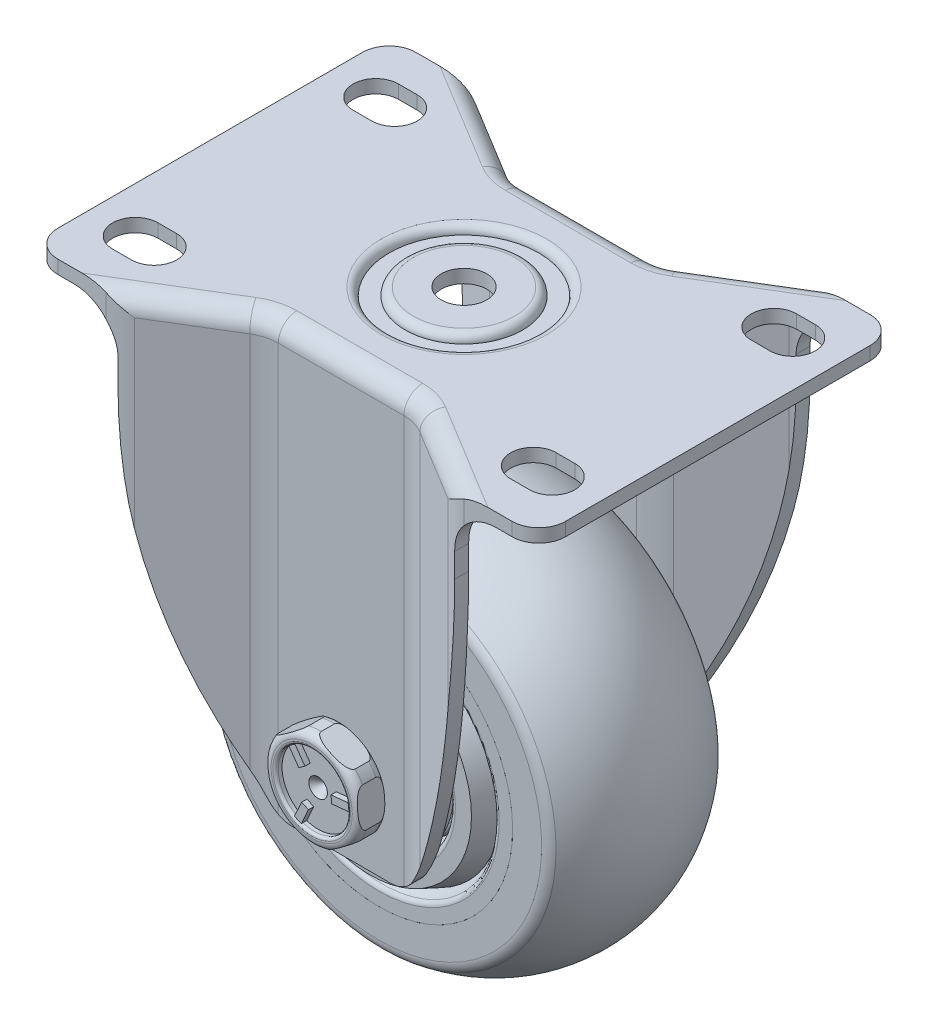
SolidWorks part; units mm, degrees
ref_plane "前视基准面" through (0, 0, 0) normal (0, 0, 1) x (1, 0, 0)
ref_plane "上视基准面" through (0, 0, 0) normal (0, 1, 0) x (1, 0, 0)
ref_plane "右视基准面" through (0, 0, 0) normal (1, 0, 0) x (0, 0, -1)
imported_body "3寸双轴内芯_默认-1-solid1"
imported_body "轴承6001_默认-1-solid1"
imported_body "轴承6001_默认-1-solid2"
imported_body "轴承6001_默认-1-solid3"
imported_body "轴承6001_默认-1-solid4"
imported_body "轴承6001_默认-1-solid5"
imported_body "轴承6001_默认-1-solid6"
imported_body "轴承6001_默认-1-solid7"
imported_body "轴承6001_默认-1-solid8"
imported_body "轴承6001_默认-1-solid9"
imported_body "轴承6001_默认-1-solid10"
imported_body "3寸固定支架_默认-1-solid1"
imported_body "轴承6001_默认-2-solid1"
imported_body "轴承6001_默认-2-solid2"
imported_body "轴承6001_默认-2-solid3"
imported_body "轴承6001_默认-2-solid4"
imported_body "轴承6001_默认-2-solid5"
imported_body "轴承6001_默认-2-solid6"
imported_body "轴承6001_默认-2-solid7"
imported_body "轴承6001_默认-2-solid8"
imported_body "轴承6001_默认-2-solid9"
imported_body "轴承6001_默认-2-solid10"
imported_body "M10-55螺杆-1-solid1"
imported_body "双轴盖仔_默认-1-solid1"
imported_body "40.2mm中型中管_默认-1-solid1"
imported_body "双轴盖仔_默认-2-solid1"
imported_body "3寸半孤平边外包_默认-1-solid1"
imported_body "M10螺母-1-solid1"
sketch "草图1" plane through (0, 0, 23) normal (0, 0, 1) x (1, 0, 0)
  line L1 (-8.6327, -6.4342) -> (3.717, -6.4342)
  line L2 (-8.6327, -6.4342) -> (-8.6327, -35.0979)
  line L3 (-8.6327, -35.0979) -> (3.717, -35.0979)
  line L4 (3.717, -6.4342) -> (3.717, -35.0979)
extrude "凸台-拉伸1" add sketch "草图1" against normal blind 1
sketch "草图2" plane through (0, 0, -16.1) normal (0, 0, -1) x (-1, 0, 0)
  circle A0 centre (3.1439, -51.6986) radius 30.4248
  circle A1 centre (3.1439, -51.6986) radius 25
extrude "切除-拉伸1" cut sketch "草图2" along normal up to surface (0.35 mm away)
